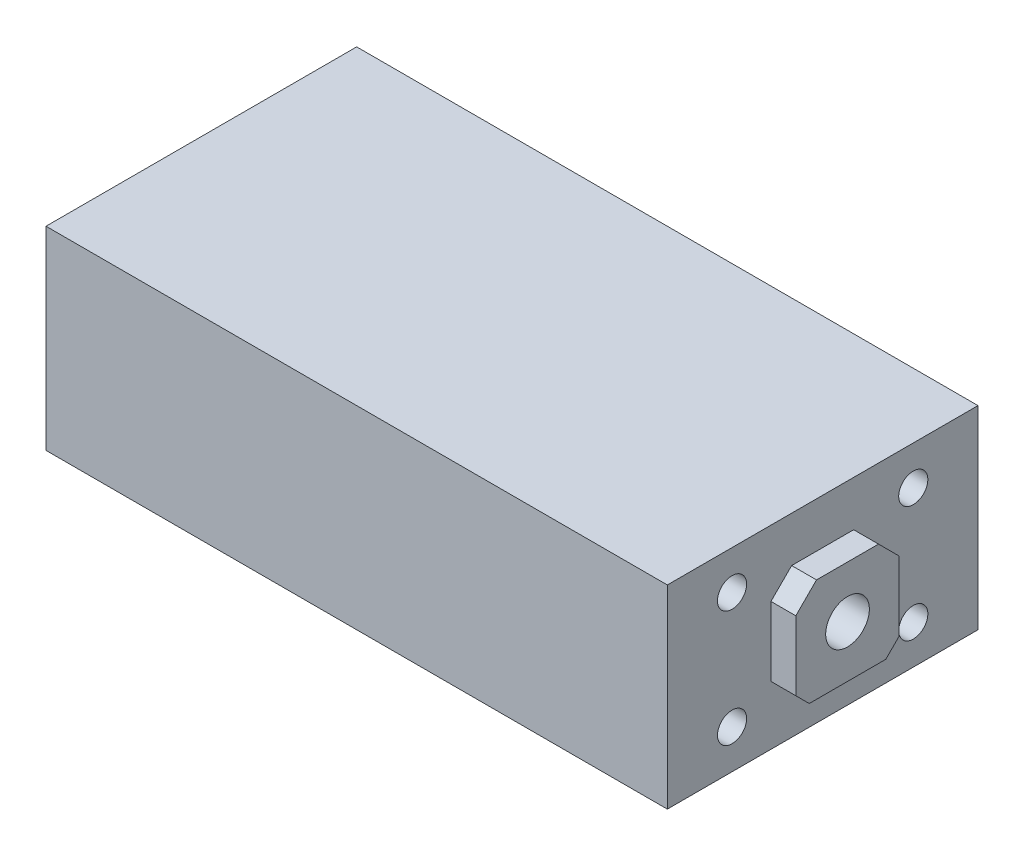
SolidWorks part; units mm, degrees
ref_plane "Front Plane" through (0, 0, 0) normal (0, 0, 1) x (1, 0, 0)
ref_plane "Top Plane" through (0, 0, 0) normal (0, 1, 0) x (1, 0, 0)
ref_plane "Right Plane" through (0, 0, 0) normal (1, 0, 0) x (0, 0, -1)
sketch "Sketch1" plane through (0, 0, 0) normal (1, 0, 0) x (0, 0, -1)
  line L1 (-38.1, -23.8125) -> (38.1, -23.8125)
  line L2 (-38.1, -23.8125) -> (-38.1, 23.8125)
  line L3 (-38.1, 23.8125) -> (38.1, 23.8125)
  line L4 (38.1, -23.8125) -> (38.1, 23.8125)
  line L5 (-38.1, -23.8125) -> (38.1, 23.8125) construction
  line L6 (-38.1, 23.8125) -> (38.1, -23.8125) construction
  point P0 (0, 0)
  dimension "D1" = 76.2
  dimension "D2" = 47.625
extrude "Boss-Extrude1" add sketch "Sketch1" against normal blind 152.4
sketch "Sketch2" plane through (0, 0, 0) normal (1, 0, 0) x (0, 0, -1)
  line L0 (0, 0) -> (-50000, 0) construction
  line L1 (0, 0) -> (0, 50000) construction
  line L2 (-12.6848, 0) -> (-12.6848, 7.6048)
  line L3 (-12.6848, 7.6048) -> (-7.6048, 12.6848)
  line L4 (-7.6048, 12.6848) -> (7.6048, 12.6848)
  line L5 (-12.6848, 0) -> (-12.6848, -9.3828)
  line L6 (-12.6848, -9.3828) -> (-9.3828, -12.6848)
  line L7 (-9.3828, -12.6848) -> (9.3828, -12.6848)
  line L8 (12.6848, -9.3828) -> (9.3828, -12.6848)
  line L9 (12.6848, 0) -> (12.6848, -9.3828)
  line L10 (12.6848, 7.6048) -> (7.6048, 12.6848)
  line L11 (12.6848, 0) -> (12.6848, 7.6048)
  point P11 (0, -12.6848)
  point P16 (0, 12.6848)
  dimension "D1" = 25.3695
  dimension "D2" = 25.3695
  dimension "D3" = 45
  dimension "D4" = 5.08
  dimension "D5" = 45
  dimension "D6" = 3.302
  dimension "D7" = 12.6848
  dimension "D8" = 12.6848
extrude "Boss-Extrude2" add sketch "Sketch2" along normal blind 6.096
hole_wizard "9/32 (0.28125) Diameter Hole1" positions "Sketch4" profile "Sketch3" hole size "9/32" standard "Ansi Inch"
sketch "Sketch4" plane through (0, 0, 0) normal (1, 0, 0) x (0, 0, -1)
  line L0 (0, 19.8116) -> (0, -49980.1884) construction
  line L1 (-74.4615, 0) -> (-50074.4615, 0) construction
  point P0 (-22.225, 14.2748)
  point P1 (-22.225, -14.2748)
  point P8 (22.225, -14.2748)
  point P9 (22.225, 14.2748)
  dimension "D1" = 22.225
  dimension "D2" = 14.2748
sketch "Sketch3" plane through (0, 14.2748, 22.225) normal (0, 1, 0) x (0, 0, -1)
  line L0 (0, 0) -> (0, 8.4962)
  line L1 (0, 8.4962) -> (3.5719, 6.35)
  line L2 (3.5719, 6.35) -> (3.5719, 0)
  line L5 (3.5719, 0) -> (0, 0)
  line L10 (0, 8.4962) -> (-3.5719, 6.35) construction
  line L11 (0, -6.35) -> (0, 107.95) construction
  dimension "Hole Dia." = 7.1437
  dimension "Hole Depth" = 6.35
  dimension "Drill Angle" = 118
hole_wizard "27/64 (0.42188) Diameter Hole1" positions "Sketch6" profile "Sketch5" hole size "27/64" standard "Ansi Inch"
sketch "Sketch6" plane through (6.096, 0, 0) normal (1, 0, 0) x (0, 0, -1)
  point P0 (0, 0)
sketch "Sketch5" plane through (6.096, 0, 0) normal (0, 1, 0) x (0, 0, -1)
  line L0 (0, 0) -> (0, 25.4443)
  line L1 (0, 25.4443) -> (5.3579, 22.225)
  line L2 (5.3579, 22.225) -> (5.3579, 0)
  line L5 (5.3579, 0) -> (0, 0)
  line L10 (0, 25.4443) -> (-5.3579, 22.225) construction
  line L11 (0, -6.35) -> (0, 107.95) construction
  dimension "Hole Dia." = 10.7158
  dimension "Hole Depth" = 22.225
  dimension "Drill Angle" = 118
